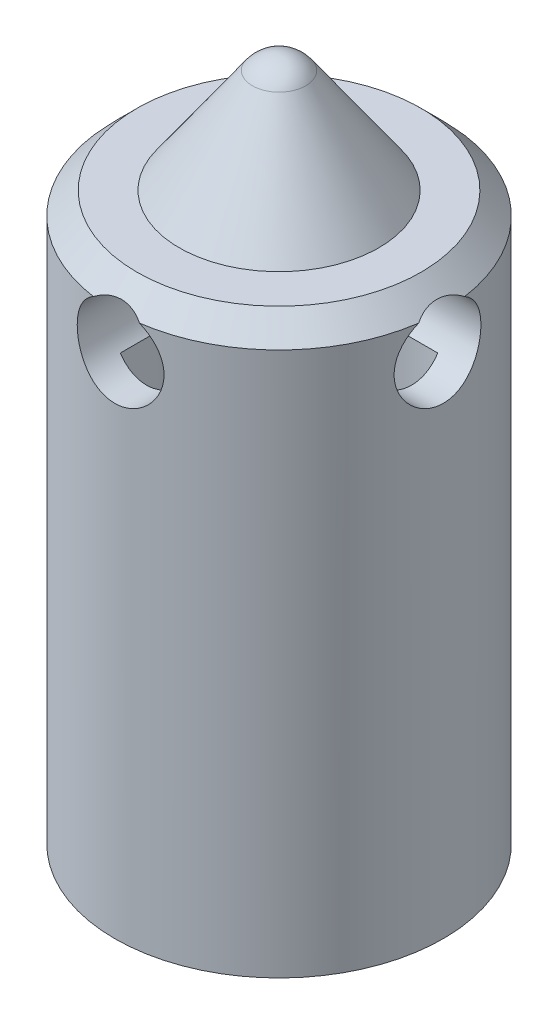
SolidWorks part; units mm, degrees
ref_plane "Front Plane" through (0, 0, 0) normal (0, 0, 1) x (1, 0, 0)
ref_plane "Top Plane" through (0, 0, 0) normal (0, 1, 0) x (1, 0, 0)
ref_plane "Right Plane" through (0, 0, 0) normal (1, 0, 0) x (0, 0, -1)
sketch "Sketch1" plane through (0, 0, 0) normal (0, 0, 1) x (1, 0, 0)
  line L0 (0, 0) -> (3.0036, 0)
  line L1 (3.0036, 0) -> (3.0036, 9.9441)
  line L2 (0, 12.5016) -> (0, 0)
  line L3 (0.488, 12.2484) -> (1.8247, 10.3505)
  line L4 (0, 13.603) -> (0, -0.3948) construction
  line L6 (2.5971, 10.3505) -> (3.0036, 9.9441)
  line L8 (2.5971, 10.3505) -> (1.8247, 10.3505)
  arc A3 (0.488, 12.2484) -> (0, 12.5016) centre (0, 11.9048) ccw
revolve "Revolve1" add sketch "Sketch1" angle 360 about L4
sketch "Sketch3" plane through (0, 0, 0) normal (0, 0, 1) x (1, 0, 0)
  line L0 (0, 0) -> (2.4257, 0)
  line L1 (-3.0036, 0) -> (3.0036, 0) construction
  line L2 (2.4257, 0) -> (2.4257, 8.6868)
  line L3 (2.4257, 8.6868) -> (0, 8.6868)
  line L4 (0, 8.6868) -> (0, 0)
  line L5 (0, 9.9441) -> (0, -0.4187) construction
  line L6 (3.0036, 9.9441) -> (-3.0036, 9.9441) construction
revolve "Cut-Revolve1" cut sketch "Sketch3" angle 360 about L5
sketch "Sketch4" plane through (0, 0, 0) normal (0, 0, 1) x (1, 0, 0)
  circle A0 centre (0, 9.271) radius 0.7937
extrude "Cut-Extrude10" cut sketch "Sketch4" against normal mid plane 10
sketch "Sketch6" plane through (0, 0, 0) normal (1, 0, 0) x (0, 0, -1)
  circle A0 centre (0, 9.271) radius 0.7937
extrude "Cut-Extrude11" cut sketch "Sketch6" against normal mid plane 10
ref_plane "Plane1" through (0, 12.4968, 0) normal (0, -1, 0) x (1, 0, 0)
sketch "Sketch7" plane through (0, 12.4968, 0) normal (0, -1, 0) x (1, 0, 0)
  line L0 (0, 0) -> (0, 3.289)
ref_plane "Plane2" through (-2.5415, 11.9566, 0) normal (0.2079, -0.9781, 0) x (0.9781, 0.2079, 0)
